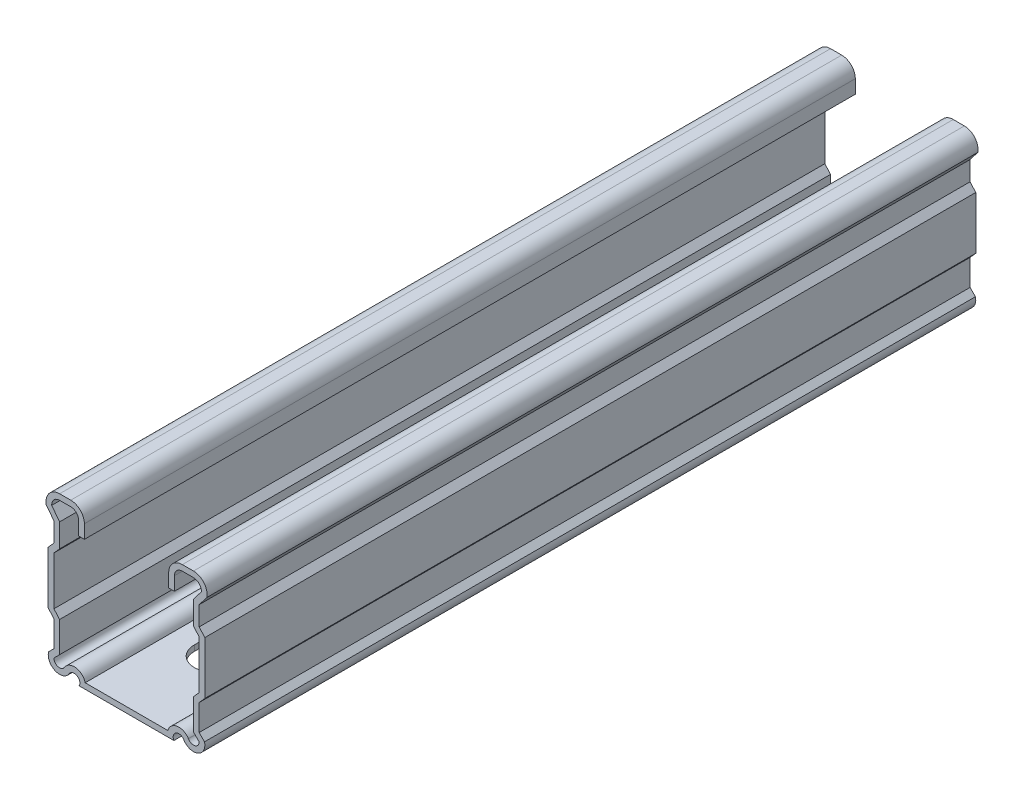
SolidWorks part; units mm, degrees
ref_plane "Plane1" through (0, 0, 0) normal (0, 0, 1) x (1, 0, 0)
ref_plane "Plane2" through (0, 0, 0) normal (0, 1, 0) x (1, 0, 0)
ref_plane "Plane3" through (0, 0, 0) normal (1, 0, 0) x (0, 0, -1)
other "Configuration Table"
sketch "Sketch1" plane through (0, 0, 0) normal (0, 0, 1) x (1, 0, 0)
  line L0 (17.6403, 16.3393) -> (19.7299, 19.0635)
  line L1 (17.6403, -13.9795) -> (19.1389, -15.4781)
  line L2 (-17.6403, -13.9795) -> (-19.1389, -15.4781)
  line L4 (-17.6403, -13.9795) -> (-17.6403, -5.9368)
  line L5 (17.6403, 21.2598) -> (14.7033, 21.2598)
  line L6 (12.6111, 19.1676) -> (12.6111, 15.6147)
  line L7 (-17.6403, -5.9368) -> (-19.1389, -4.2539)
  line L8 (-12.6111, 19.1676) -> (-12.6111, 15.6147)
  line L9 (0, 10.16) -> (0, -7.62) construction
  line L10 (-19.1389, -4.2539) -> (-19.1389, 8.4957)
  line L11 (-17.6403, 10.1786) -> (-19.1389, 8.4957)
  line L12 (-17.6403, 10.1786) -> (-17.6403, 16.3393)
  line L13 (-17.6403, 16.3393) -> (-19.7299, 19.0635)
  line L14 (-17.6403, 21.2598) -> (-14.7033, 21.2598)
  line L16 (17.6403, -13.9795) -> (17.6403, -5.9368)
  line L17 (17.6403, 10.1786) -> (17.6403, 16.3393)
  line L18 (-11.1125, 19.1676) -> (-11.1125, 15.6147)
  line L19 (-17.6403, 22.7584) -> (-14.7033, 22.7584)
  line L20 (-19.1389, 15.8307) -> (-21.1624, 18.4689)
  line L21 (-19.1389, 10.7491) -> (-19.1389, 15.8307)
  line L22 (-19.1389, 10.7491) -> (-20.6375, 9.0662)
  line L23 (-20.6375, -4.8244) -> (-20.6375, 9.0662)
  line L24 (-19.1389, -6.5073) -> (-20.6375, -4.8244)
  line L25 (19.1389, -4.2539) -> (19.1389, 8.4957)
  line L26 (-19.1389, -13.3588) -> (-19.1389, -6.5073)
  line L27 (-19.1389, -13.3588) -> (-20.5535, -14.7733)
  line L28 (11.1125, 19.1676) -> (11.1125, 15.6147)
  line L29 (17.6403, 22.7584) -> (14.7033, 22.7584)
  line L30 (19.1389, 15.8307) -> (21.1624, 18.4689)
  line L31 (19.1389, 10.7491) -> (19.1389, 15.8307)
  line L32 (19.1389, 10.7491) -> (20.6375, 9.0662)
  line L33 (20.6375, -4.8244) -> (20.6375, 9.0662)
  line L34 (19.1389, -6.5073) -> (20.6375, -4.8244)
  line L35 (19.1389, -13.3588) -> (19.1389, -6.5073)
  line L36 (19.1389, -13.3588) -> (20.5535, -14.7733)
  line L37 (17.6403, -5.9368) -> (19.1389, -4.2539)
  line L38 (-12.4806, -18.5166) -> (12.4806, -18.5166)
  line L39 (17.6403, 10.1786) -> (19.1389, 8.4957)
  line L41 (-10.899, -17.018) -> (10.899, -17.018)
  line L42 (-12.6111, 15.6147) -> (-11.1125, 15.6147)
  line L43 (11.1125, 15.6147) -> (12.6111, 15.6147)
  arc A0 (19.1389, -15.4781) -> (16.3052, -16.1588) centre (17.6403, -15.4781) cw
  arc A1 (16.3052, -16.1588) -> (10.899, -17.018) centre (13.7938, -17.7947) ccw
  arc A2 (-16.4143, -16.3399) -> (-10.899, -17.018) centre (-13.7938, -17.7947) cw
  arc A3 (-19.1389, -15.4781) -> (-16.4143, -16.3399) centre (-17.6403, -15.4781) ccw
  arc A4 (-17.6403, 21.2598) -> (-19.7299, 19.0635) centre (-17.6403, 19.1676) ccw
  arc A5 (-12.6111, 19.1676) -> (-14.7033, 21.2598) centre (-14.7033, 19.1676) ccw
  arc A6 (17.6403, 21.2598) -> (19.7299, 19.0635) centre (17.6403, 19.1676) cw
  arc A7 (12.6111, 19.1676) -> (14.7033, 21.2598) centre (14.7033, 19.1676) cw
  arc A8 (-11.1125, 19.1676) -> (-14.7033, 22.7584) centre (-14.7033, 19.1676) ccw
  arc A9 (-17.6403, 22.7584) -> (-21.1624, 18.4689) centre (-17.6403, 19.1676) ccw
  arc A10 (-20.5535, -14.7733) -> (-15.0198, -16.9329) centre (-17.6403, -15.4781) ccw
  arc A11 (11.1125, 19.1676) -> (14.7033, 22.7584) centre (14.7033, 19.1676) cw
  arc A12 (17.6403, 22.7584) -> (21.1624, 18.4689) centre (17.6403, 19.1676) cw
  arc A13 (20.5535, -14.7733) -> (15.0198, -16.9329) centre (17.6403, -15.4781) cw
  arc A14 (15.0198, -16.9329) -> (12.4806, -18.5166) centre (13.7938, -17.7947) ccw
  arc A15 (-15.0198, -16.9329) -> (-12.4806, -18.5166) centre (-13.7938, -17.7947) cw
  dimension "D9" = 7.1437
  dimension "base" = 18.5166
  dimension "D5" = 9.525
  dimension "ToeHt" = 22.7584
  dimension "D6" = 22.225
  dimension "D8" = 15.4781
  dimension "D12" = 41.275
  dimension "D14" = 13.6922
  dimension "D15" = 13.8906
extrude "Base-Extrude" add sketch "Sketch1" along normal blind 203.2
extrude "LSlot" cut sketch "Sketch2" against normal through all
sketch "Sketch2" plane through (-0.0935, -18.5166, -16.4661) normal (0, -1, 0) x (1, 0, 0)
  line L0 (5.2528, 95.0473) -> (5.2528, 29.1661)
  line L1 (-5.0659, 29.1661) -> (-5.0659, 95.0473)
  arc A0 (-5.0659, 29.1661) -> (5.2528, 29.1661) centre (0.0935, 29.1661) ccw
  arc A1 (5.2528, 95.0473) -> (-5.0659, 95.0473) centre (0.0935, 95.0473) ccw
  dimension "D3" = 10.3187
  dimension "D1" = 12.7
  dimension "D2" = 65.8813
pattern_linear "LPattern1" count 2 spacing 101.6 along (0, 0, 1) of "LSlot"
equation "\"D1@LPattern1\" = \"D1@Base-Extrude\" / \"D3@LPattern1\""
